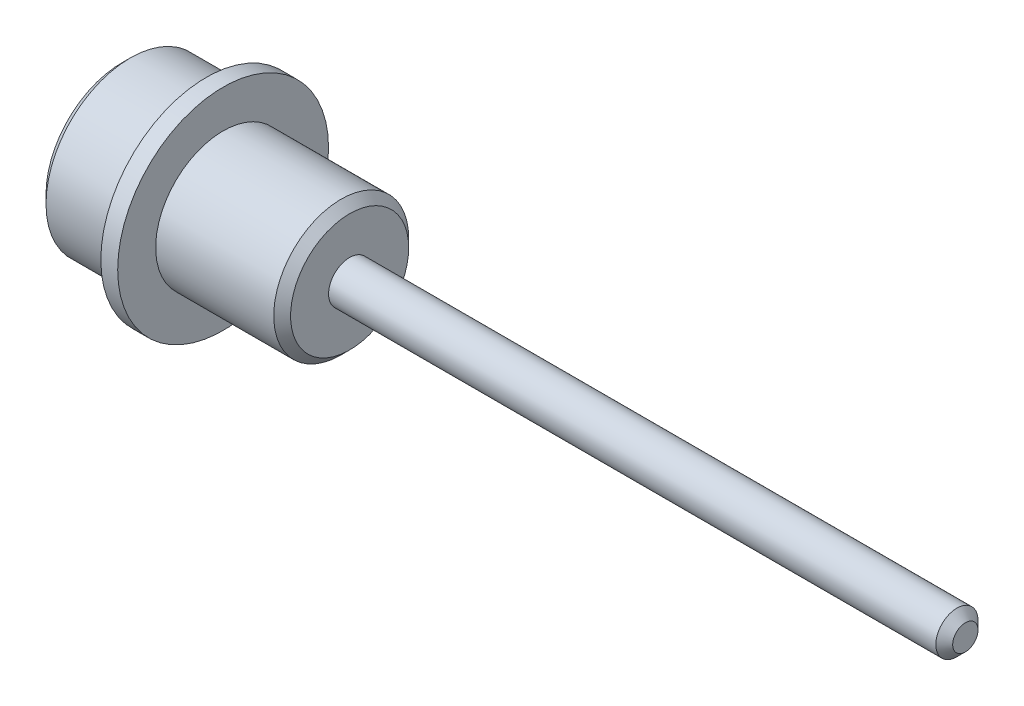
SolidWorks part; units mm, degrees
ref_plane "Спереди" through (0, 0, 0) normal (0, 0, 1) x (1, 0, 0)
ref_plane "Сверху" through (0, 0, 0) normal (0, 1, 0) x (1, 0, 0)
ref_plane "Справа" through (0, 0, 0) normal (1, 0, 0) x (0, 0, -1)
sketch "Sketch1" plane through (0, 0, 0) normal (0, 0, 1) x (1, 0, 0)
  line L0 (81.1761, 0) -> (-10.8235, 0) construction
  line L1 (0, 0) -> (0, 10)
  line L2 (0, 10) -> (10, 10)
  line L3 (10, 10) -> (10, 12.5)
  line L4 (10, 12.5) -> (12, 12.5)
  line L5 (12, 12.5) -> (12, 8)
  line L6 (12, 8) -> (27, 8)
  line L7 (27, 8) -> (27, 2.5)
  line L8 (27, 2.5) -> (100, 2.5)
  line L9 (100, 2.5) -> (100, 0)
  line L10 (100, 0) -> (0, 0)
  dimension "D1" = 16
  dimension "D2" = 2
  dimension "D3" = 20
  dimension "D4" = 10
  dimension "D5" = 25
  dimension "D6" = 15
  dimension "D7" = 5
  dimension "D8" = 100
revolve "Revolve1" add sketch "Sketch1" angle 360 about L0
chamfer "Chamfer1" distance 1 angle 45 3 edges at (0, 0, -10) (100, 0, -2.5) (27, 0, -8)
